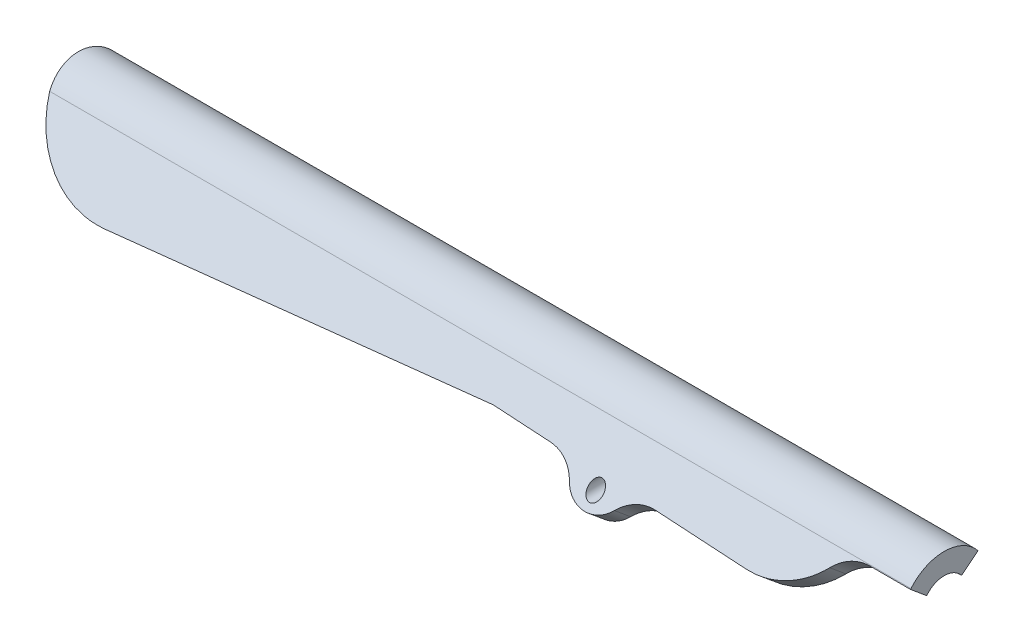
SolidWorks part; units mm, degrees
ref_plane "Front Plane" through (0, 0, 0) normal (0, 0, 1) x (1, 0, 0)
ref_plane "Top Plane" through (0, 0, 0) normal (0, 1, 0) x (1, 0, 0)
ref_plane "Right Plane" through (0, 0, 0) normal (1, 0, 0) x (0, 0, -1)
sketch "Sketch1" plane through (0, 0, 0) normal (0, 1, 0) x (1, 0, 0)
  line L0 (0, 0) -> (72.4995, 0) construction
  line L1 (0.5113, 6.3294) -> (25.4112, 4.318)
  line L2 (25.4112, 4.318) -> (31.1168, 4.564)
  line L3 (25.4112, 0) -> (25.4112, 7.352) construction
  line L4 (25.4112, -4.318) -> (31.1168, -4.564)
  line L5 (47.869, 1.9812) -> (52.07, 1.9812)
  line L6 (33.02, -13.8102) -> (33.02, 13.2495) construction
  line L7 (47.869, -1.9812) -> (52.07, -1.9812)
  line L8 (52.07, 1.9812) -> (52.07, -1.9812)
  line L9 (0.5113, -6.3294) -> (25.4112, -4.318)
  line L10 (34.9232, 4.7282) -> (42.9724, 5.0753)
  line L11 (34.9232, -4.7282) -> (42.9724, -5.0753)
  arc A0 (0.5113, 6.3294) -> (0.5113, -6.3294) centre (0, 0) ccw
  circle A1 centre (25.4112, 0) radius 4.318 construction
  arc A2 (42.9724, -5.0753) -> (47.869, -1.9812) centre (43.1912, 0) ccw
  arc A3 (47.869, 1.9812) -> (42.9724, 5.0753) centre (43.1912, 0) ccw
  arc A4 (31.1168, -4.564) -> (34.9232, -4.7282) centre (33.02, -4.6461) ccw
  arc A5 (34.9232, 4.7282) -> (31.1168, 4.564) centre (33.02, 4.6461) ccw
  dimension "D1" = 12.7
  dimension "D2" = 8.636
  dimension "D3" = 10.16
  dimension "D5" = 17.78
  dimension "D6" = 58.42
  dimension "D10" = 3.81
  dimension "D7" = 3.9624
  dimension "D8" = 1.9812
  dimension "D9" = 19.05
  dimension "D11" = 9.2922
extrude "Extrude1" add sketch "Sketch1" along normal blind 1.4224
fillet "Fillet1" radius 2.54 6 edges at (47.869, 0.7112, 1.9812) (47.869, 0.7112, -1.9812) (34.9232, 0.7112, 4.7282) (31.1168, 0.7112, 4.564) (34.9232, 0.7112, -4.7282) (31.1168, 0.7112, -4.564)
other "Flex1" parameters "D0"=105, "D1"=5.6858, "D2"=5.5103
sketch "Sketch2" plane through (0, 0, 0) normal (0, 0, 1) x (1, 0, 0)
  line L0 (33.02, -3.1767) -> (33.02, 3.5253) construction
  circle A0 centre (33.02, -2.2944) radius 0.508
  ellipse E0 centre (33.02, -1.7127) end of major axis (31.115, -1.7127) minor radius 1.464 (31.4112, -2.4968) -> (34.535, -2.6003) ccw construction
  dimension "D1" = 1.016
extrude "Cut-Extrude1" cut sketch "Sketch2" against normal through all and the other way through all
